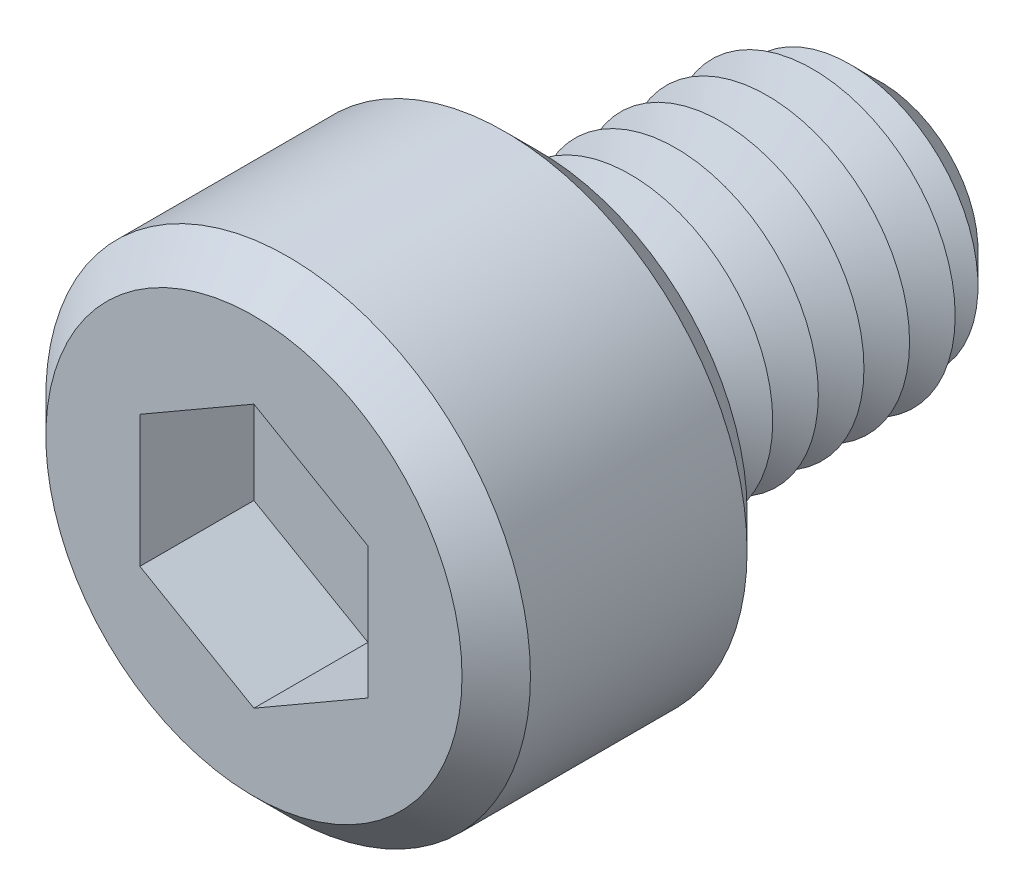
SolidWorks part; units mm, degrees
ref_plane "Front Plane" through (0, 0, 0) normal (0, 0, 1) x (1, 0, 0)
ref_plane "Top Plane" through (0, 0, 0) normal (0, 1, 0) x (1, 0, 0)
ref_plane "Right Plane" through (0, 0, 0) normal (1, 0, 0) x (0, 0, -1)
sketch "Sketch1" plane through (0, 0, 0) normal (0, 0, 1) x (1, 0, 0)
  circle A0 centre (0, 0) radius 4.25
  dimension "D1" = 8.5
extrude "Boss-Extrude1" add sketch "Sketch1" along normal blind 5
sketch "Sketch2" plane through (0, 0, 0) normal (0, 0, -1) x (-1, 0, 0)
  circle A0 centre (0, 0) radius 2.5
  dimension "D1" = 5
extrude "Boss-Extrude2" add sketch "Sketch2" along normal blind 6
chamfer "Chamfer1" distance 0.8 angle 45 1 edges at (-2.5, 0, -6)
sketch "Sketch3" plane through (0, 0, 0) normal (1, 0, 0) x (0, 0, -1)
  line L0 (-2.5121, 0) -> (4.5776, 0) construction
sketch "Sketch4" plane through (0, 0, 0) normal (1, 0, 0) x (0, 0, -1)
  line L0 (0, 2.5) -> (0.4, 1.8072)
  line L1 (0.4, 1.8072) -> (0.8, 2.5)
  line L2 (5.2, 2.5) -> (0, 2.5) construction
  line L3 (0.8, 2.5) -> (0, 2.5)
  dimension "D1" = 0.8
revolve "Cut-Revolve1" cut sketch "Sketch4" angle 360 about L0
pattern_linear "LPattern1" count 7 spacing 0.8 along (0, 0, -1) of "Cut-Revolve1"
sketch "Sketch5" plane through (0, 0, 5) normal (0, 0, 1) x (1, 0, 0)
  line L1 (0, 2.3094) -> (-2, 1.1547)
  line L2 (-2, 1.1547) -> (-2, -1.1547)
  line L3 (-2, -1.1547) -> (0, -2.3094)
  line L4 (0, -2.3094) -> (2, -1.1547)
  line L5 (2, -1.1547) -> (2, 1.1547)
  line L6 (2, 1.1547) -> (0, 2.3094)
  circle A0 centre (0, 0) radius 2 construction
  dimension "D1" = 4
extrude "Cut-Extrude1" cut sketch "Sketch5" against normal blind 2
sketch "Sketch6" plane through (0, 0, 3) normal (0, 0, 1) x (1, 0, 0)
  circle A0 centre (0, 0) radius 0.65
  dimension "D1" = 1.3
extrude "Cut-Extrude2" cut sketch "Sketch6" against normal up to surface (9 mm away)
chamfer "Chamfer2" distance 0.6 angle 45 2 edges at (4.25, 0, 0) (4.25, 0, 5)
